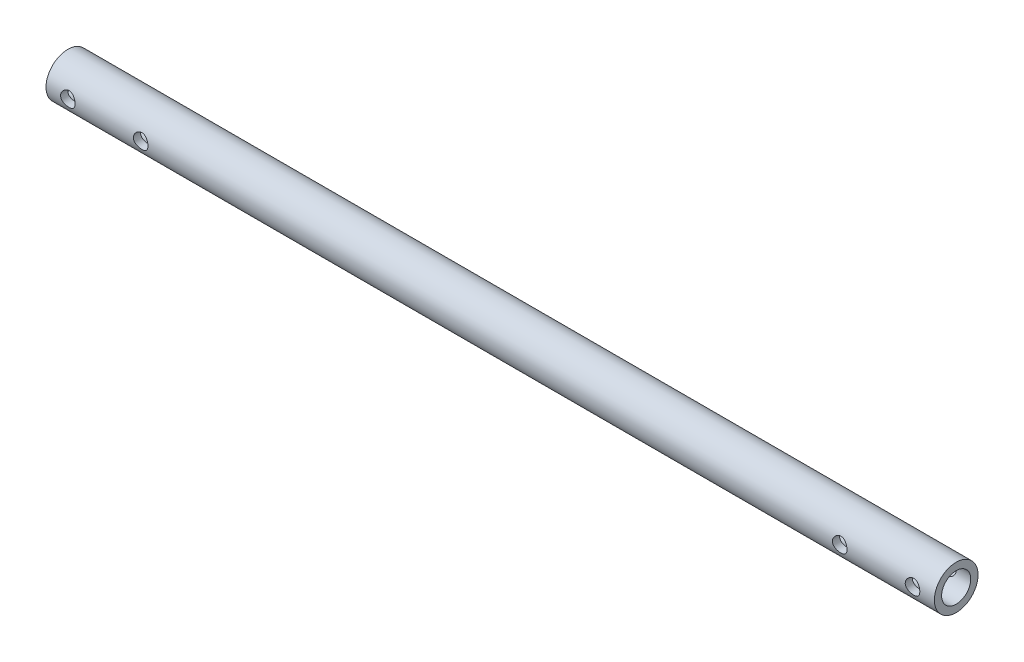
SolidWorks part; units mm, degrees
ref_plane "Front Plane" through (0, 0, 0) normal (0, 0, 1) x (1, 0, 0)
ref_plane "Top Plane" through (0, 0, 0) normal (0, 1, 0) x (1, 0, 0)
ref_plane "Right Plane" through (0, 0, 0) normal (1, 0, 0) x (0, 0, -1)
sketch "Sketch1" plane through (0, 0, 0) normal (0, 0, 1) x (1, 0, 0)
  line L0 (0, -9.525) -> (387.35, -9.525)
  line L1 (387.35, -9.525) -> (387.35, 9.525)
  line L2 (387.35, 9.525) -> (0, 9.525)
  line L3 (0, 9.525) -> (0, -9.525)
  line L4 (9.525, -9.525) -> (9.525, 9.525)
  line L5 (41.275, -9.525) -> (41.275, 9.525)
  line L6 (377.825, -9.525) -> (377.825, 9.525)
  line L7 (346.075, -9.525) -> (346.075, 9.525)
  line L8 (0, 0) -> (9.525, 0) construction
  line L9 (0, 6.35) -> (387.35, 6.35)
  line L10 (9.525, 0) -> (41.275, 0) construction
  line L11 (346.075, 0) -> (377.825, 0) construction
  circle A4 centre (9.525, 0) radius 3.175
  circle A5 centre (41.275, 0) radius 3.175
  circle A6 centre (346.075, 0) radius 3.175
  circle A7 centre (377.825, 0) radius 3.175
  dimension "D3" = 9.525
  dimension "D8" = 6.35
  dimension "D1" = 387.35
  dimension "D2" = 19.05
  dimension "D5" = 9.525
  dimension "D6" = 31.75
  dimension "D7" = 3.175
sketch "Sketch2" plane through (0, 0, 0) normal (0, 0, 1) x (1, 0, 0)
  line L0 (0, 6.35) -> (387.35, 6.35) construction
  line L1 (0, 9.525) -> (0, -9.525) construction
  line L2 (387.35, -9.525) -> (387.35, 9.525) construction
  line L3 (387.35, 9.525) -> (0, 9.525) construction
  line L4 (0, 6.35) -> (387.35, 6.35)
  line L5 (0, 9.525) -> (0, 6.35)
  line L6 (387.35, 6.35) -> (387.35, 9.525)
  line L7 (387.35, 9.525) -> (0, 9.525)
revolve "Revolve1" add sketch "Sketch2" angle 360 about L8
sketch "Sketch3" plane through (0, 0, 0) normal (0, 0, 1) x (1, 0, 0)
  circle A0 centre (9.525, 0) radius 3.175 construction
  circle A1 centre (41.275, 0) radius 3.175 construction
  circle A2 centre (346.075, 0) radius 3.175 construction
  circle A3 centre (377.825, 0) radius 3.175 construction
  circle A4 centre (9.525, 0) radius 3.175
  circle A5 centre (41.275, 0) radius 3.175
  circle A6 centre (346.075, 0) radius 3.175
  circle A7 centre (377.825, 0) radius 3.175
extrude "Cut-Extrude1" cut sketch "Sketch3" against normal mid plane 50.8
